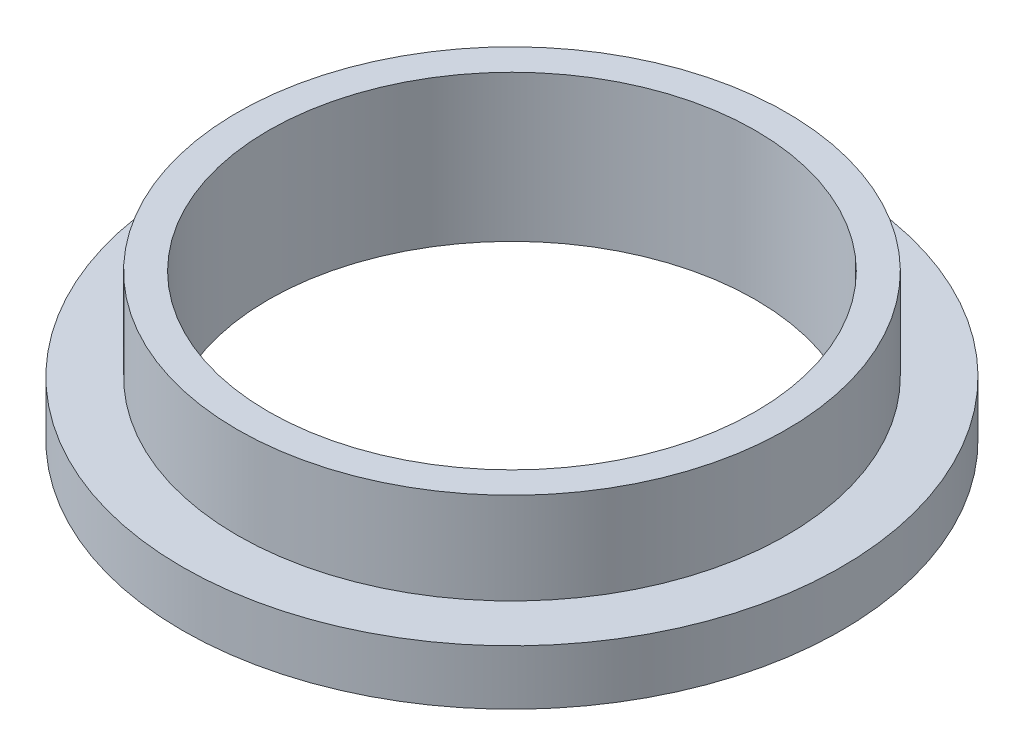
SolidWorks part; units mm, degrees
ref_plane "Front" through (0, 0, 0) normal (0, 0, 1) x (1, 0, 0)
ref_plane "Top" through (0, 0, 0) normal (0, 1, 0) x (1, 0, 0)
ref_plane "Right" through (0, 0, 0) normal (1, 0, 0) x (0, 0, -1)
sketch "Sketch1" plane through (0, 0, 0) normal (0, 1, 0) x (1, 0, 0)
  circle A0 centre (0, 0) radius 6
  circle A1 centre (0, 0) radius 7.5
  circle A2 centre (0, 0) radius 9
  dimension "ID" = 12
  dimension "OD" = 15
  dimension "FlangeOD" = 18
sketch "Sketch2" plane through (0, 0, 0) normal (0, 1, 0) x (1, 0, 0)
  circle A0 centre (0, 0) radius 6 construction
  circle A1 centre (0, 0) radius 7.5 construction
  circle A2 centre (0, 0) radius 6
  circle A3 centre (0, 0) radius 7.5
extrude "Boss-Extrude1" add sketch "Sketch2" along normal blind 8
sketch "Sketch3" plane through (0, 0, 0) normal (0, 1, 0) x (1, 0, 0)
  circle A0 centre (0, 0) radius 9 construction
  circle A1 centre (0, 0) radius 7.5 construction
  circle A2 centre (0, 0) radius 9
  circle A3 centre (0, 0) radius 7.5
extrude "Boss-Extrude2" add sketch "Sketch3" along normal blind 1.5
sketch "Sketch4" plane through (0, 8, 0) normal (0, 1, 0) x (1, 0, 0)
  circle A0 centre (0, 0) radius 6.65
  dimension "D1" = 13.3
extrude "Cut-Extrude1" cut sketch "Sketch4" against normal blind 10
sketch "Sketch5" plane through (0, 8, 0) normal (0, 1, 0) x (1, 0, 0)
  circle A0 centre (0, 0) radius 10.4945
extrude "Cut-Extrude2" cut sketch "Sketch5" against normal blind 4
